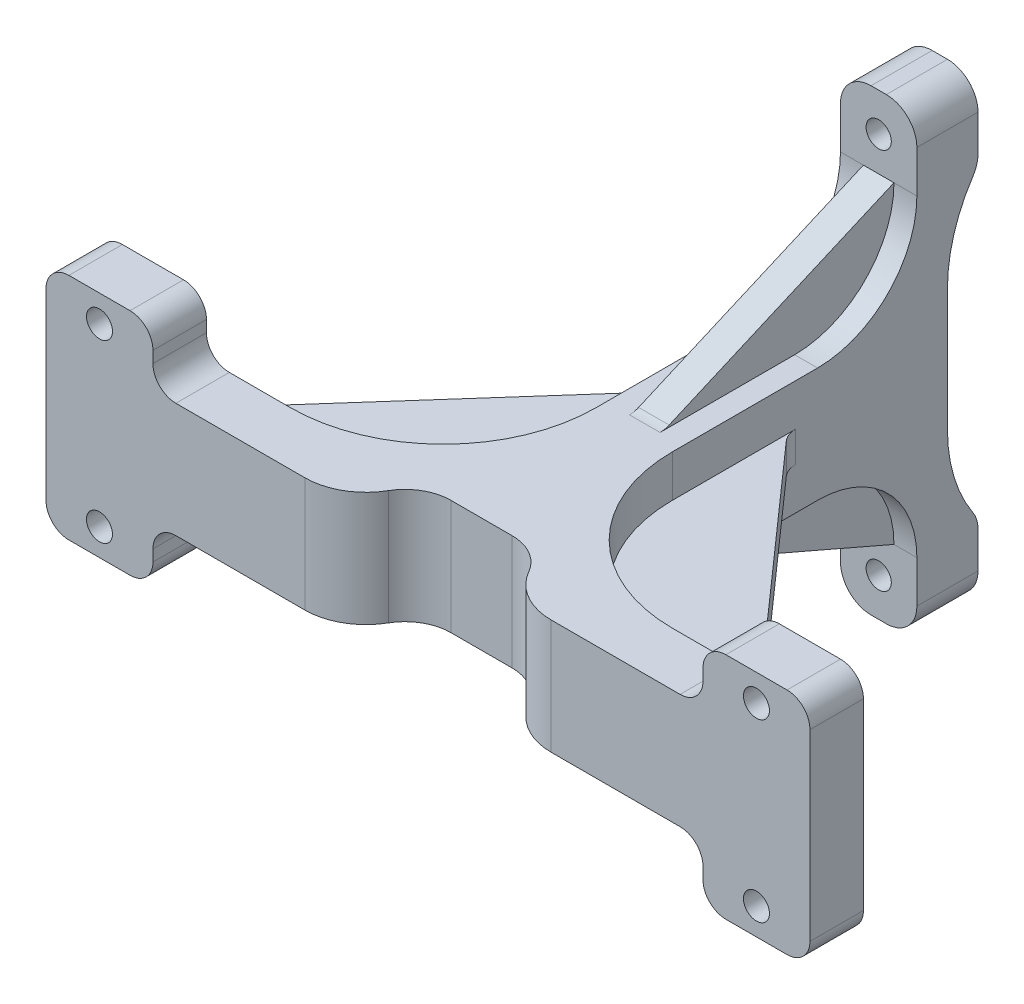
SolidWorks part; units mm, degrees
ref_plane "前视基准面" through (0, 0, 0) normal (0, 0, 1) x (1, 0, 0)
ref_plane "上视基准面" through (0, 0, 0) normal (0, 1, 0) x (1, 0, 0)
ref_plane "右视基准面" through (0, 0, 0) normal (1, 0, 0) x (0, 0, -1)
other "Configuration Table"
sketch "草图1" plane through (0, 0, 0) normal (0, 0, 1) x (1, 0, 0)
  line L1 (-5, -30) -> (5, -30)
  line L2 (-5, -30) -> (-5, 30)
  line L3 (-5, 30) -> (5, 30)
  line L4 (5, -30) -> (5, 30)
  line L5 (-5, -30) -> (5, 30) construction
  line L6 (-5, 30) -> (5, -30) construction
  point P0 (0, 0)
  dimension "D1" = 10
  dimension "D2" = 60
extrude "凸台-拉伸1" add sketch "草图1" along normal blind 60
sketch "草图2" plane through (0, 0, 60) normal (0, 0, 1) x (1, 0, 0)
  line L1 (-50, -7.5) -> (50, -7.5)
  line L2 (-50, -7.5) -> (-50, 7.5)
  line L3 (-50, 7.5) -> (50, 7.5)
  line L4 (50, -7.5) -> (50, 7.5)
  line L5 (-50, -7.5) -> (50, 7.5) construction
  line L6 (-50, 7.5) -> (50, -7.5) construction
  point P0 (0, 0)
  dimension "D1" = 100
  dimension "D2" = 15
extrude "凸台-拉伸2" add sketch "草图2" along normal blind 7
sketch "草图3" plane through (-5, 0, 0) normal (-1, 0, 0) x (0, 0, 1)
  line L0 (67, 7.5) -> (60, 7.5) construction
  line L1 (60, 30) -> (8, 30)
  line L2 (60, 30) -> (60, 7.5)
  line L3 (60, 7.5) -> (8, 7.5)
  line L4 (8, 30) -> (8, 7.5)
  line L5 (0, 0) -> (60, 0) construction
  line L6 (0, 30) -> (0, -30) construction
  line L7 (60, 7.5) -> (60, -7.5) construction
  line L8 (8, -30) -> (8, -7.5)
  line L9 (60, -7.5) -> (8, -7.5)
  line L10 (60, -30) -> (60, -7.5)
  line L11 (60, -30) -> (8, -30)
  dimension "D1" = 8
extrude "切除-拉伸2" cut sketch "草图3" against normal up to surface (10 mm away)
sketch "草图4" plane through (0, 0, 0) normal (0, 0, -1) x (-1, 0, 0)
  line L0 (0, -25) -> (0, 25) construction
  circle A0 centre (0, 25) radius 1.65
  circle A1 centre (0, -25) radius 1.65
  dimension "D2" = 3.3
  dimension "D1" = 50
extrude "切除-拉伸3" cut sketch "草图4" against normal up to surface (8 mm away)
fillet "圆角1" radius 13 2 edges at (0, -7.5, 8) (0, 7.5, 8)
sketch "草图6" plane through (0, 0, 0) normal (0, 0, -1) x (-1, 0, 0)
  line L0 (5, 30) -> (5, -30) construction
  line L1 (-5, -20) -> (5, -20)
  line L2 (-5, -20) -> (-5, 20)
  line L3 (-5, 20) -> (5, 20)
  line L4 (5, -20) -> (5, 20)
  line L5 (-5, -20) -> (5, 20) construction
  line L6 (-5, 20) -> (5, -20) construction
  point P0 (0, 0)
  dimension "D1" = 40
extrude "切除-拉伸4" cut sketch "草图6" against normal blind 4
fillet "圆角2" radius 20 2 edges at (0, -20, 4) (0, 20, 4)
fillet "圆角3" radius 20 2 edges at (5, 0, 60) (-5, 0, 60)
fillet "圆角4" radius 4 6 edges at (5, 30, 4) (-5, 30, 4) (5, -30, 4) (-5, -30, 4) (0, 20, 0) (0, -20, 0)
sketch "草图7" plane through (0, 0, 67) normal (0, 0, 1) x (1, 0, 0)
  line L0 (50, 7.5) -> (-50, 7.5) construction
  line L1 (-10, -7.5) -> (10, -7.5)
  line L2 (-10, -7.5) -> (-10, 7.5)
  line L3 (-10, 7.5) -> (10, 7.5)
  line L4 (10, -7.5) -> (10, 7.5)
  line L5 (-10, -7.5) -> (10, 7.5) construction
  line L6 (-10, 7.5) -> (10, -7.5) construction
  point P0 (0, 0)
  dimension "D1" = 20
extrude "切除-拉伸5" cut sketch "草图7" against normal blind 7
fillet "圆角5" radius 6 2 edges at (10, 0, 60) (-10, 0, 60)
fillet "圆角7" radius 8 2 edges at (-10, 0, 67) (10, 0, 67)
sketch "草图10" plane through (0, 0, 60) normal (0, 0, -1) x (-1, 0, 0)
  line L1 (-50, 7.5) -> (-36, 7.5)
  line L2 (-50, 7.5) -> (-50, 15)
  line L3 (-50, 15) -> (-36, 15)
  line L4 (-36, 7.5) -> (-36, 15)
  dimension "D1" = 7.5
  dimension "D2" = 14
extrude "凸台-拉伸3" add sketch "草图10" against normal up to surface (7 mm away)
mirror "镜向1" about plane through (0, 0, 0) normal (0, 1, 0) of "凸台-拉伸3"
mirror "镜向2" about plane through (0, 0, 0) normal (1, 0, 0) of "镜向1", "凸台-拉伸3"
sketch "草图11" plane through (0, 0, 67) normal (0, 0, 1) x (1, 0, 0)
  line L0 (43, -15) -> (43, 15) construction
  line L1 (50, -15) -> (36, -15) construction
  line L2 (50, 15) -> (36, 15) construction
  line L3 (43, -11.5) -> (43, 11.5) construction
  circle A0 centre (43, 11.5) radius 1.7
  circle A1 centre (43, -11.5) radius 1.7
  point P8 (43, 0)
  dimension "D2" = 3.4
  dimension "D3" = 3.4
  dimension "D1" = 23
extrude "切除-拉伸7" cut sketch "草图11" against normal up to surface (7 mm away)
mirror "镜向3" about plane through (0, 0, 0) normal (1, 0, 0) of "切除-拉伸7"
sketch "草图12" plane through (0, 0, 0) normal (0, 1, 0) x (1, 0, 0)
  line L0 (-5, -25) -> (-36, -60)
  line L2 (-25, -60) -> (-36, -60) construction
  dimension "D1" = 35
rib "筋2" sketch "草图12" sketch "草图12" thickness 4 extrusion direction parallel to sketch draft on no parameters "D1"=4
mirror "镜向4" about plane through (0, 0, 0) normal (1, 0, 0) of "筋2"
sketch "草图13" plane through (0, 0, 0) normal (1, 0, 0) x (0, 0, -1)
  line L0 (-38, -7.5) -> (-8, -20.5)
  line L1 (-21, -7.5) -> (-40, -7.5) construction
  line L2 (-8, -26) -> (-8, -20.5) construction
  dimension "D1" = 30
  dimension "D2" = 13
rib "筋3" sketch "草图13" sketch "草图13" thickness 4 extrusion direction parallel to sketch draft on no parameters "D1"=4
mirror "镜向5" about plane through (0, 0, 0) normal (0, 1, 0) of "筋3"
fillet "圆角10" radius 3 18 edges at (-36, 7.5, 63.5) (-36, 15, 63.5) (-50, 15, 63.5) (-50, -15, 63.5) (-36, -15, 63.5) (-36, -7.5, 63.5) (50, -15, 63.5) (36, -15, 63.5) (50, 15, 63.5) (36, 15, 63.5) (36, 7.5, 63.5) (36, -7.5, 63.5) (36, 0, 60) (-36, 0, 60) (0, -7.5, 38) (5, 0, 25) (0, 7.5, 38) (-5, 0, 25)
